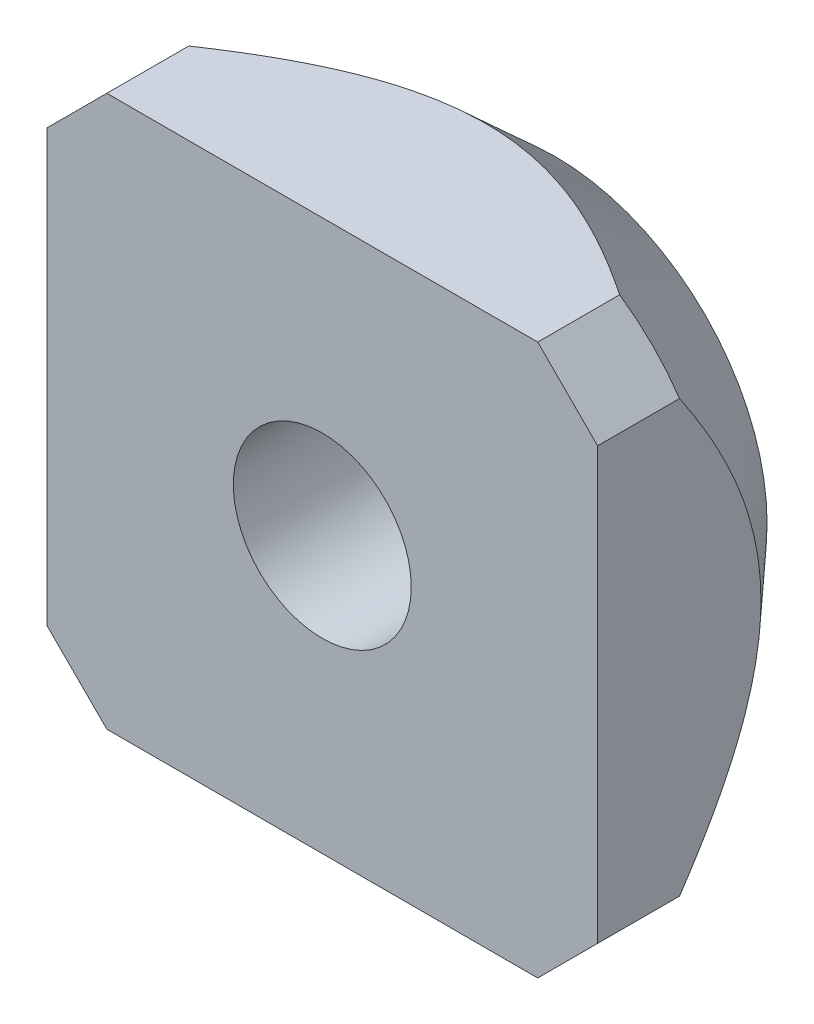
SolidWorks part; units mm, degrees
ref_plane "Front" through (0, 0, 0) normal (0, 0, 1) x (1, 0, 0)
ref_plane "Top" through (0, 0, 0) normal (0, 1, 0) x (1, 0, 0)
ref_plane "Right" through (0, 0, 0) normal (1, 0, 0) x (0, 0, -1)
imported_body "Imported1"
hole_wizard "M5x0.8 Tapped Hole1" positions "3DSketch1" profile "Sketch1" tap size "M5x0.8" standard "Ansi Metric"
sketch3d "3DSketch1"
  line L0 (-6.5, 5.0858, 0) -> (-6.5, -5.0858, 0) construction
  line L1 (5.0858, 6.5, 0) -> (-5.0858, 6.5, 0) construction
  point P0 (0, 0, 0)
  dimension "D1" = 6.5
  dimension "D2" = 6.5
sketch "Sketch1" plane through (0, 0, 0) normal (1, 0, 0) x (0, -1, 0)
  line L0 (0, 0) -> (0, 15.2618)
  line L1 (0, 15.2618) -> (2.1, 14)
  line L2 (2.1, 14) -> (2.1, 0)
  line L5 (2.1, 0) -> (0, 0)
  line L10 (0, 15.2618) -> (-2.1, 14) construction
  line L11 (0, -6.35) -> (0, 107.95) construction
  dimension "Tap Drill Dia." = 4.2
  dimension "Tap Drill Depth" = 14
  dimension "Drill Angle" = 118
